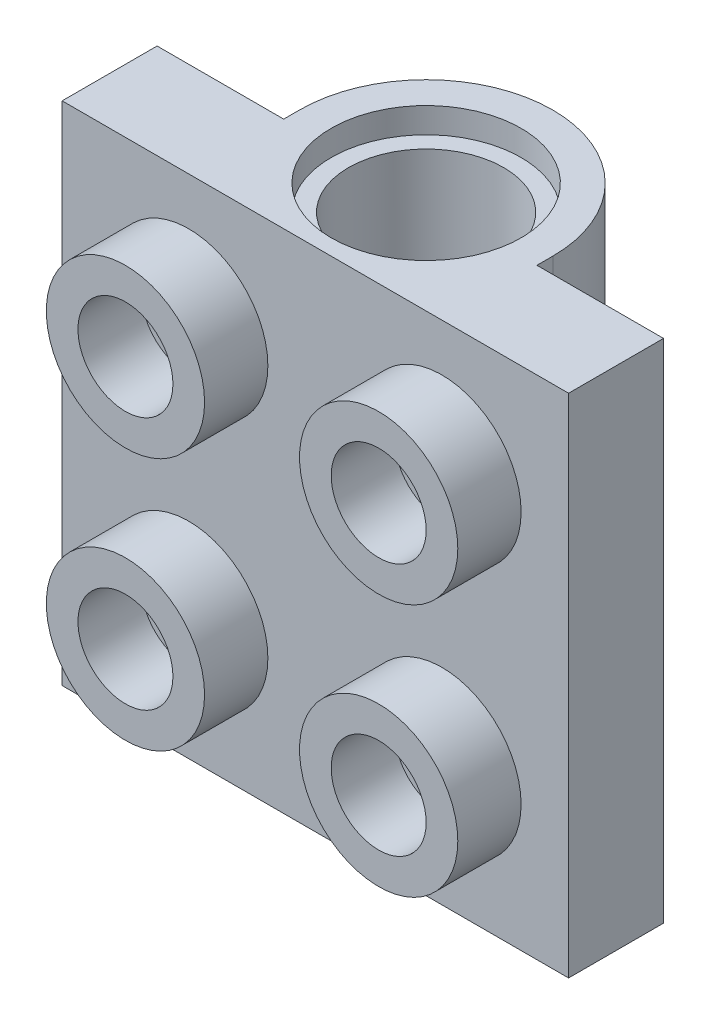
SolidWorks part; units mm, degrees
ref_plane "정면" through (0, 0, 0) normal (0, 0, 1) x (1, 0, 0)
ref_plane "윗면" through (0, 0, 0) normal (0, 1, 0) x (1, 0, 0)
ref_plane "우측면" through (0, 0, 0) normal (1, 0, 0) x (0, 0, -1)
sketch "스케치1" plane through (0.0073, -0.1313, 0) normal (0, 0, 1) x (1, 0, 0)
  line L1 (-8.5849, 7.9996) -> (7.4151, 7.9996)
  line L2 (-8.5849, 7.9996) -> (-8.5849, -8.0004)
  line L3 (-8.5849, -8.0004) -> (7.4151, -8.0004)
  line L4 (7.4151, 7.9996) -> (7.4151, -8.0004)
  dimension "D1" = 16
  dimension "D2" = 16
extrude "베이스돌출" add sketch "스케치1" against normal blind 3
sketch "스케치2" plane through (0, 0, 0) normal (0, 0, 1) x (1, 0, 0)
  line L0 (-8.5776, 7.8683) -> (-8.5776, -8.1317) construction
  line L1 (-8.5776, -8.1317) -> (7.4224, -8.1317) construction
  circle A0 centre (-4.5776, -4.1317) radius 2.5
  dimension "D1" = 5
  dimension "D2" = 4
  dimension "D3" = 4
extrude "보스-돌출1" add sketch "스케치2" along normal blind 2
pattern_linear "선형 패턴1" count 2 spacing 8 along (1, 0, 0) count 2 spacing 8 along (0, 1, 0) of "보스-돌출1"
sketch "스케치3" plane through (0, 0, -3) normal (0, 0, -1) x (-1, 0, 0)
  line L0 (8.5776, -8.1317) -> (-7.4224, -8.1317) construction
  line L1 (7.0776, -6.6317) -> (-5.9224, -6.6317)
  line L2 (7.0776, -6.6317) -> (7.0776, 6.3683)
  line L3 (7.0776, 6.3683) -> (-5.9224, 6.3683)
  line L4 (-5.9224, -6.6317) -> (-5.9224, 6.3683)
  line L5 (-7.4224, -8.1317) -> (-7.4224, 7.8683) construction
  line L6 (-7.4224, 7.8683) -> (8.5776, 7.8683) construction
  line L7 (8.5776, 7.8683) -> (8.5776, -8.1317) construction
  dimension "D1" = 1.5
  dimension "D2" = 1.5
  dimension "D3" = 1.5
  dimension "D4" = 1.5
extrude "컷-돌출1" cut sketch "스케치3" against normal blind 2
sketch "스케치4" plane through (0, -8.1317, 0) normal (0, -1, 0) x (1, 0, 0)
  line L0 (5.9224, 2) -> (0.9224, 2) construction
  line L1 (-8.5776, -3) -> (-8.5776, 0) construction
  line L2 (3.4224, -3.5) -> (3.4224, 0)
  line L3 (3.4224, 0) -> (-4.5776, 0)
  line L4 (-4.5776, -3.5) -> (-4.5776, 0)
  line L5 (-8.5776, 0) -> (7.4224, 0) construction
  arc A0 (-4.5776, -3.5) -> (3.4224, -3.5) centre (-0.5776, -3.5) ccw
  dimension "D1" = 4
  dimension "D2" = 5.5
  dimension "D3" = 8
extrude "보스-돌출2" add sketch "스케치4" against normal up to vertex
sketch "스케치5" plane through (0, -8.1317, 0) normal (0, -1, 0) x (1, 0, 0)
  circle A0 centre (-0.5776, -3.5) radius 2.45
  arc A1 (-4.5776, -3.5) -> (3.4224, -3.5) centre (-0.5776, -3.5) ccw construction
  dimension "D1" = 4.9
extrude "컷-돌출2" cut sketch "스케치5" against normal up to vertex
sketch "스케치6" plane through (0, -8.1317, 0) normal (0, -1, 0) x (1, 0, 0)
  circle A0 centre (-0.5776, -3.5) radius 3
  dimension "D1" = 6
extrude "컷-돌출3" cut sketch "스케치6" against normal blind 0.8
sketch "스케치7" plane through (1.8382, 7.8683, 1.2116) normal (0, 1, 0) x (-1, 0, 0)
  circle A0 centre (2.4158, -4.7116) radius 3
  arc A2 (-1.5842, -4.7116) -> (6.4158, -4.7116) centre (2.4158, -4.7116) ccw construction
  dimension "D1" = 6
extrude "컷-돌출4" cut sketch "스케치7" against normal blind 0.8
sketch "스케치8" plane through (0, 0, -1) normal (0, 0, -1) x (-1, 0, 0)
  line L0 (-7.4224, 7.8683) -> (-3.4224, 7.8683) construction
  line L1 (-4.9298, -1.1317) -> (5.8211, -1.1317)
  line L2 (-4.9298, -1.1317) -> (-4.9298, 0.8683)
  line L3 (-4.9298, 0.8683) -> (5.8211, 0.8683)
  line L4 (5.8211, -1.1317) -> (5.8211, 0.8683)
  dimension "D1" = 2
  dimension "D2" = 7
extrude "컷-돌출5" cut sketch "스케치8" along normal blind 7
sketch "스케치9" plane through (0, 0, 2) normal (0, 0, 1) x (1, 0, 0)
  circle A0 centre (-4.5776, -4.1317) radius 1.5
  circle A1 centre (-4.5776, -4.1317) radius 2.5 construction
  dimension "D1" = 3
extrude "컷-돌출6" cut sketch "스케치9" against normal up to vertex (2 mm away)
pattern_linear "선형 패턴2" count 2 spacing 8 along (0, 1, 0) count 2 spacing 8 along (1, 0, 0) of "컷-돌출6"
